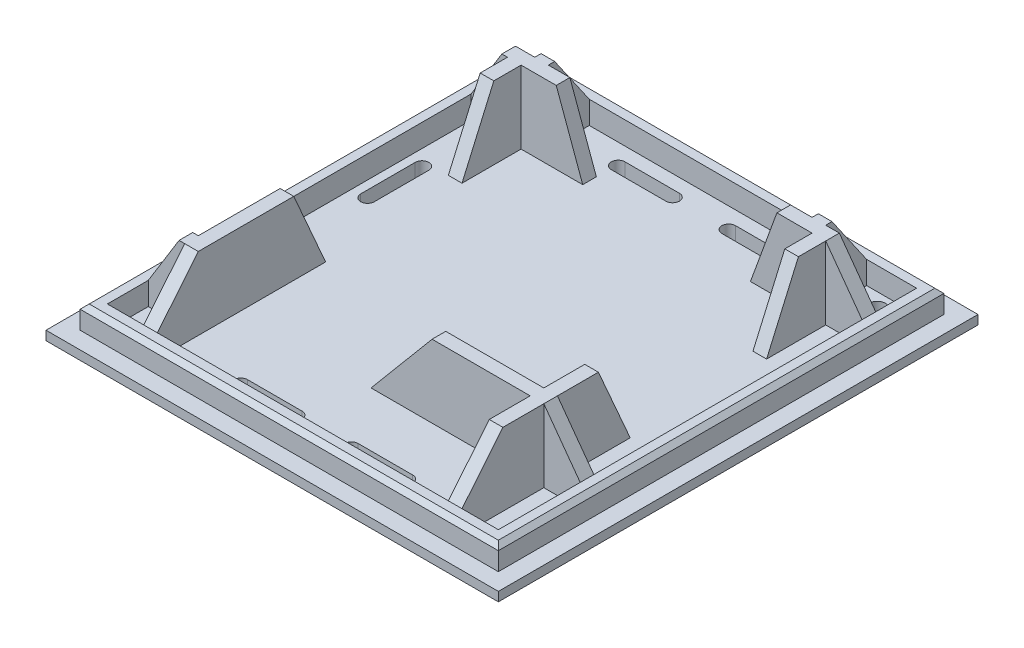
SolidWorks part; units mm, degrees
ref_plane "Front Plane" through (0, 0, 0) normal (0, 0, 1) x (1, 0, 0)
ref_plane "Top Plane" through (0, 0, 0) normal (0, 1, 0) x (1, 0, 0)
ref_plane "Right Plane" through (0, 0, 0) normal (1, 0, 0) x (0, 0, -1)
sketch "Sketch1" plane through (0, 0, 0) normal (0, 1, 0) x (1, 0, 0)
  line L0 (-43, 46) -> (-43, 49) construction
  line L1 (-46, 49) -> (46, 49)
  line L2 (-46, 49) -> (-46, -49)
  line L3 (-46, -49) -> (46, -49)
  line L4 (46, 49) -> (46, -49)
  line L5 (-43, 46) -> (43, 46)
  line L6 (-43, 46) -> (-43, -46)
  line L7 (-43, -46) -> (43, -46)
  line L8 (43, 46) -> (43, -46)
  line L9 (-43, 49) -> (-46, 46) construction
  line L10 (-46, 46) -> (-43, 46) construction
  line L11 (43, -46) -> (46, -46) construction
  line L12 (46, -46) -> (43, -49) construction
  line L13 (43, -49) -> (43, -46) construction
  point P4 (0, 49)
  point P6 (-46, 0)
  dimension "D1" = 92
  dimension "D2" = 3
  dimension "D3" = 98
extrude "Lip" add sketch "Sketch1" along normal blind 5
sketch "Sketch2" plane through (0, 0, 0) normal (0, -1, 0) x (1, 0, 0)
  line L1 (-49.75, 52.75) -> (49.75, 52.75)
  line L2 (-49.75, 52.75) -> (-49.75, -52.75)
  line L3 (-49.75, -52.75) -> (49.75, -52.75)
  line L4 (49.75, 52.75) -> (49.75, -52.75)
  line L6 (-46, 49) -> (-46, 52.75) construction
  line L7 (-46, 52.75) -> (-49.75, 49) construction
  line L8 (-49.75, 49) -> (-46, 49) construction
  line L9 (46, -49) -> (49.75, -49) construction
  line L10 (49.75, -49) -> (46, -52.75) construction
  line L11 (46, -52.75) -> (46, -49) construction
  point P4 (0, 52.75)
  point P6 (-49.75, 0)
  dimension "D1" = 3.75
extrude "Base" add sketch "Sketch2" along normal blind 3
sketch "Sketch3" plane through (0, 0, 0) normal (0, 1, 0) x (1, 0, 0)
  line L0 (0, 46) -> (0, -46) construction
  line L5 (-49.75, 0) -> (49.75, 0) construction
  line L6 (-49.75, -52.75) -> (-49.75, 52.75) construction
  line L7 (49.75, 52.75) -> (49.75, -52.75) construction
  line L8 (43, 46) -> (-43, 46) construction
  line L9 (-43, -46) -> (43, -46) construction
  circle A0 centre (-36.195, 42.865) radius 1.84
  circle A1 centre (37.465, 42.865) radius 1.84
  circle A2 centre (-40.005, -42.865) radius 1.84
  circle A3 centre (40.005, -42.865) radius 1.84
  dimension "D7" = 3.68
  dimension "D1" = 36.195
  dimension "D2" = 37.465
  dimension "D3" = 40.005
  dimension "D4" = 40.005
  dimension "D5" = 42.865
  dimension "D6" = 42.865
extrude "Bolts Cut" cut sketch "Sketch3" against normal up to next
sketch "Sketch4" plane through (0, 0, 0) normal (0, 1, 0) x (1, 0, 0)
  line L0 (-43, 34) -> (-35, 34)
  line L1 (-32, 34) -> (32, 34)
  line L2 (-32, 34) -> (-32, -46)
  line L4 (32, 34) -> (32, -46)
  line L5 (43, -46) -> (43, 46) construction
  line L6 (-43, 46) -> (-43, -46) construction
  line L7 (-35, 34) -> (-35, -34)
  line L8 (32, -28) -> (-3, -28)
  line L9 (-35, -34) -> (-43, -34)
  line L10 (-43, 46) -> (-43, -46) construction
  line L11 (-43, -34) -> (-43, -37)
  line L12 (-43, -37) -> (-35, -37)
  line L13 (32, -28) -> (32, -25)
  line L14 (-35, -37) -> (-35, -46)
  line L15 (-43, -46) -> (43, -46) construction
  line L16 (-35, -46) -> (-32, -46)
  line L17 (32, -25) -> (-3, -25)
  line L18 (-43, -46) -> (43, -46) construction
  line L19 (-3, -28) -> (-3, -25)
  line L23 (32, -46) -> (35, -46)
  line L24 (35, -46) -> (35, -28)
  line L25 (35, -28) -> (43, -28)
  line L27 (43, -46) -> (43, 46) construction
  line L28 (43, -28) -> (43, -25)
  line L29 (43, -25) -> (35, -25)
  line L30 (35, -25) -> (35, 34)
  line L31 (35, 34) -> (43, 34)
  line L32 (43, 34) -> (43, 37)
  line L33 (43, 37) -> (32, 37)
  line L35 (32, 37) -> (32, 46)
  line L36 (43, 46) -> (-43, 46) construction
  line L37 (32, 46) -> (29, 46)
  line L38 (29, 46) -> (29, 37)
  line L39 (29, 37) -> (-29, 37)
  line L40 (-29, 37) -> (-29, 46)
  line L41 (-29, 46) -> (-32, 46)
  line L42 (-32, 46) -> (-32, 37)
  line L43 (-32, 37) -> (-43, 37)
  line L44 (-43, 37) -> (-43, 34)
  point P4 (0, 34)
  dimension "D1" = 64
  dimension "D2" = 11
  dimension "D3" = 3
  dimension "D4" = 3
  dimension "D5" = 21
  dimension "D6" = 35
  dimension "D7" = 9
extrude "Battery Guard" add sketch "Sketch4" along normal blind 16
sketch "Sketch6" plane through (0, 0, 37) normal (0, 0, 1) x (1, 0, 0)
  line L0 (-43, 5) -> (-35, 18)
  line L1 (-35, 18) -> (-43, 18)
  line L2 (-43, 18) -> (-43, 5)
  line L4 (-43, 0) -> (-35, 0) construction
  dimension "D1" = 18
  dimension "D2" = 8
extrude "Support Cut 1" cut sketch "Sketch6" against normal through all
sketch "Sketch7" plane through (-35, 0, 0) normal (-1, 0, 0) x (0, 0, 1)
  line L0 (37, 16) -> (46, 5)
  line L1 (46, 5) -> (46, 16)
  line L2 (46, 16) -> (37, 16)
extrude "Support Cut 2" cut sketch "Sketch7" against normal through all
sketch "Sketch8" plane through (0, 0, 28) normal (0, 0, 1) x (1, 0, 0)
  line L0 (35, 16) -> (43, 5)
  line L1 (43, 5) -> (43, 16)
  line L2 (43, 16) -> (35, 16)
extrude "Support Cut 3" cut sketch "Sketch8" against normal through all
sketch "Sketch9" plane through (32, 0, 0) normal (1, 0, 0) x (0, 0, -1)
  line L0 (37, 18) -> (46, 5)
  line L1 (46, 5) -> (46, 18)
  line L2 (46, 18) -> (37, 18)
  line L3 (37, 0) -> (46, 0) construction
  line L4 (46, 16) -> (46, 5) construction
  dimension "D1" = 9
  dimension "D2" = 18
extrude "Support Cut 4" cut sketch "Sketch9" against normal through all
sketch "Sketch10" plane through (35, 0, 0) normal (1, 0, 0) x (0, 0, -1)
  line L0 (-16, 16) -> (-9, 0)
  line L1 (-25, 16) -> (34, 16) construction
  line L2 (52.75, 0) -> (-52.75, 0) construction
  line L3 (-9, 0) -> (21, 0)
  line L4 (21, 0) -> (28, 16)
  line L5 (28, 16) -> (-16, 16)
  line L6 (-25, 0) -> (34, 0) construction
  dimension "D1" = 9
  dimension "D2" = 30
  dimension "D3" = 6
extrude "Support Wall Cut 1" cut sketch "Sketch10" against normal up to surface (70 mm away)
sketch "Sketch16" plane through (0, 0, -37) normal (0, 0, -1) x (-1, 0, 0)
  line L0 (-25, 18) -> (-18.4485, 0)
  line L2 (-29, 0) -> (29, 0) construction
  line L3 (-18.4485, 0) -> (18.4485, 0)
  line L4 (18.4485, 0) -> (25, 18)
  line L5 (25, 18) -> (-25, 18)
  dimension "D2" = 70
  dimension "D3" = 50
  dimension "D4" = 18
extrude "Support Wall Cut 2" cut sketch "Sketch16" against normal up to vertex
chamfer "Exterior Chamfers" distance 1 angle 45 8 edges at (0, 5, 49) (46, 5, 0) (0, 5, -49) (-46, 5, 0) (0, -3, -52.75) (49.75, -3, 0) (0, -3, 52.75) (-49.75, -3, 0)
sketch "Sketch13" plane through (0, 0, 0) normal (0, 1, 0) x (1, 0, 0)
  line L0 (-36.2308, 34) -> (-43, 34) construction
  line L1 (-6.1667, 40) -> (-18.1667, 40)
  line L2 (-4.6667, 43) -> (-4.6667, 40) construction
  line L3 (-38.1154, 6.3333) -> (-41.1154, 6.3333) construction
  line L4 (-6.1667, 43) -> (-18.1667, 43)
  line L5 (-38.1154, 21.3333) -> (-41.1154, 21.3333) construction
  line L6 (-19.6667, 40) -> (-19.6667, 43) construction
  line L7 (0, 0) -> (0, 46) construction
  line L8 (-41.1154, 19.8333) -> (-41.1154, 7.8333)
  line L9 (-38.1154, 7.8333) -> (-38.1154, 19.8333)
  line L10 (29, 46) -> (-29, 46) construction
  line L11 (0, 0) -> (-43, 0) construction
  line L12 (-43, 34) -> (-43, -34) construction
  line L13 (-19.6667, 41.5) -> (-29, 41.5) construction
  line L14 (4.6667, -43) -> (4.6667, -40) construction
  line L15 (-39.6154, 34) -> (-39.6154, 21.3333) construction
  line L16 (-39.6154, 6.3333) -> (-39.6154, -6.3333) construction
  line L17 (-29, 46) -> (-29, 38.3846) construction
  line L18 (-4.6667, 41.5) -> (4.6667, 41.5) construction
  line L19 (-29, 37) -> (-29, 46) construction
  line L20 (39.6154, 6.3333) -> (39.6154, -6.3333) construction
  line L21 (39.6154, 34) -> (39.6154, 21.3333) construction
  line L22 (19.6667, 41.5) -> (29, 41.5) construction
  line L23 (19.6667, 40) -> (19.6667, 43) construction
  line L24 (38.1154, 21.3333) -> (41.1154, 21.3333) construction
  line L25 (38.1154, 6.3333) -> (41.1154, 6.3333) construction
  line L26 (4.6667, 43) -> (4.6667, 40) construction
  line L27 (38.1154, 7.8333) -> (38.1154, 19.8333)
  line L28 (41.1154, 19.8333) -> (41.1154, 7.8333)
  line L29 (6.1667, 43) -> (18.1667, 43)
  line L30 (6.1667, 40) -> (18.1667, 40)
  line L31 (38.1154, -6.3333) -> (41.1154, -6.3333) construction
  line L32 (38.1154, -21.3333) -> (41.1154, -21.3333) construction
  line L33 (19.6667, -40) -> (19.6667, -43) construction
  line L34 (19.6667, -41.5) -> (29, -41.5) construction
  line L35 (39.6154, -34) -> (39.6154, -21.3333) construction
  line L36 (-4.6667, -41.5) -> (4.6667, -41.5) construction
  line L37 (-39.6154, -34) -> (-39.6154, -21.3333) construction
  line L38 (-19.6667, -41.5) -> (-29, -41.5) construction
  line L39 (-19.6667, -40) -> (-19.6667, -43) construction
  line L40 (-38.1154, -21.3333) -> (-41.1154, -21.3333) construction
  line L41 (-38.1154, -6.3333) -> (-41.1154, -6.3333) construction
  line L42 (-4.6667, -43) -> (-4.6667, -40) construction
  line L43 (6.1667, -40) -> (18.1667, -40)
  line L44 (6.1667, -43) -> (18.1667, -43)
  line L45 (41.1154, -19.8333) -> (41.1154, -7.8333)
  line L46 (38.1154, -7.8333) -> (38.1154, -19.8333)
  line L47 (-38.1154, -7.8333) -> (-38.1154, -19.8333)
  line L48 (-41.1154, -19.8333) -> (-41.1154, -7.8333)
  line L49 (-6.1667, -43) -> (-18.1667, -43)
  line L50 (-6.1667, -40) -> (-18.1667, -40)
  arc A0 (-6.1667, 43) -> (-6.1667, 40) centre (-6.1667, 41.5) cw
  arc A1 (38.1154, 19.8333) -> (41.1154, 19.8333) centre (39.6154, 19.8333) cw
  arc A2 (41.1154, 7.8333) -> (38.1154, 7.8333) centre (39.6154, 7.8333) cw
  arc A3 (18.1667, 40) -> (18.1667, 43) centre (18.1667, 41.5) ccw
  arc A4 (6.1667, 43) -> (6.1667, 40) centre (6.1667, 41.5) ccw
  arc A5 (-18.1667, 40) -> (-18.1667, 43) centre (-18.1667, 41.5) cw
  arc A6 (-38.1154, -19.8333) -> (-41.1154, -19.8333) centre (-39.6154, -19.8333) cw
  arc A7 (-41.1154, -7.8333) -> (-38.1154, -7.8333) centre (-39.6154, -7.8333) cw
  arc A8 (-41.1154, 7.8333) -> (-38.1154, 7.8333) centre (-39.6154, 7.8333) ccw
  arc A9 (-38.1154, 19.8333) -> (-41.1154, 19.8333) centre (-39.6154, 19.8333) ccw
  arc A10 (-18.1667, -40) -> (-18.1667, -43) centre (-18.1667, -41.5) ccw
  arc A11 (6.1667, -43) -> (6.1667, -40) centre (6.1667, -41.5) cw
  arc A12 (18.1667, -40) -> (18.1667, -43) centre (18.1667, -41.5) cw
  arc A13 (41.1154, -7.8333) -> (38.1154, -7.8333) centre (39.6154, -7.8333) ccw
  arc A14 (38.1154, -19.8333) -> (41.1154, -19.8333) centre (39.6154, -19.8333) ccw
  arc A15 (-6.1667, -43) -> (-6.1667, -40) centre (-6.1667, -41.5) ccw
  point P2 (-39.6154, 34)
  point P43 (-29, 41.5)
  point P45 (0, 41.5)
  point P84 (39.6154, 0)
  point P87 (-39.6154, 0)
  point P123 (0, -41.5)
  dimension "D1" = 3
  dimension "D2" = 12
extrude "Zipties" cut sketch "Sketch13" against normal up to next
sketch "Sketch17" plane through (0, 0, 28) normal (0, 0, 1) x (1, 0, 0)
  line L0 (-3, 0) -> (10.4256, 16)
  line L2 (32, 16) -> (-3, 16) construction
  dimension "D1" = 50
extrude "Battery Supp Cut for Cable" cut sketch "Sketch17" against normal blind 10 and the other way through all
